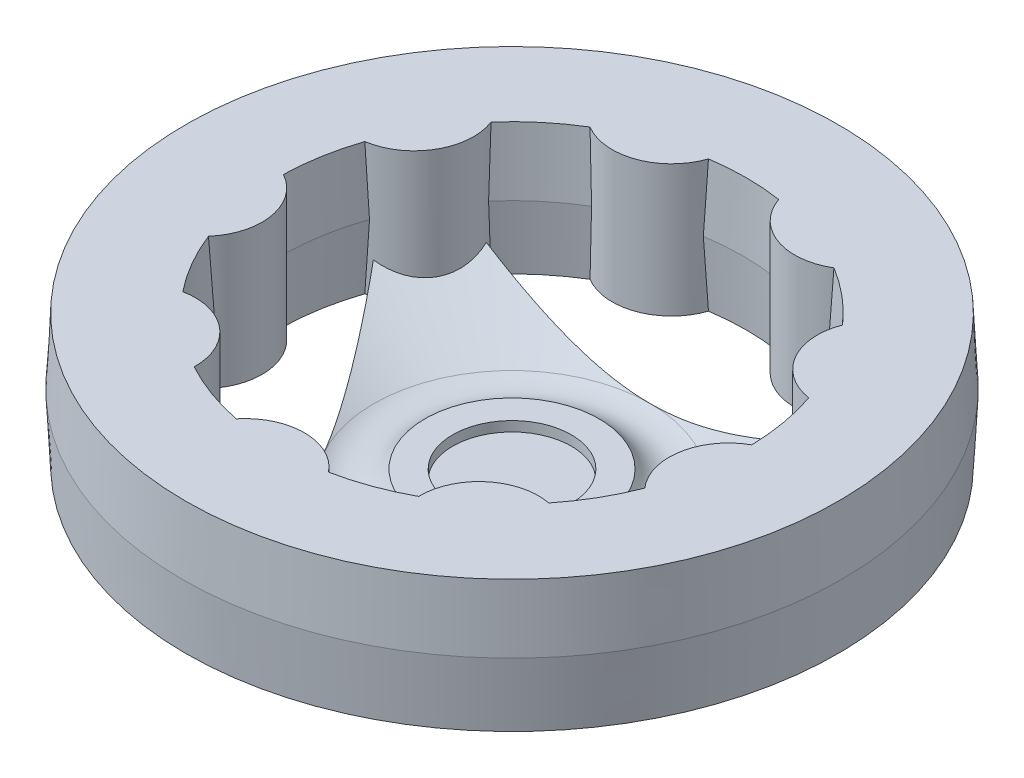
SolidWorks part; units mm, degrees
ref_plane "Front Plane" through (0, 0, 0) normal (0, 0, 1) x (1, 0, 0)
ref_plane "Top Plane" through (0, 0, 0) normal (0, 1, 0) x (1, 0, 0)
ref_plane "Right Plane" through (0, 0, 0) normal (1, 0, 0) x (0, 0, -1)
sketch "Sketch1" plane through (0, 0, 0) normal (0, 0, 1) x (1, 0, 0)
  line L0 (0, 0) -> (0, 45.9521) construction
  line L1 (0, 0) -> (12, 0)
  line L2 (12, 0) -> (12, -9.6)
  line L3 (12, -9.6) -> (13.2, -10.8)
  line L4 (13.2, -10.8) -> (13.2, -12)
  line L5 (13.2, -12) -> (12, -12)
  line L6 (12, -12) -> (12, -23.6)
  line L7 (11.6, -24) -> (2.4, -24)
  line L8 (0, -6) -> (0, 0)
  line L9 (0, -6) -> (2, -7.1547)
  line L10 (2, -7.1547) -> (2, -23.6)
  line L11 (2, -23.6) -> (2.4, -24)
  line L12 (12, -23.6) -> (11.6, -24)
  point P9 (12, -24)
  point P13 (2, -24)
revolve "Revolve1" add sketch "Sketch1" angle 360 about L0
sketch "Sketch2" plane through (0, 0, 0) normal (0, 0, 1) x (1, 0, 0)
  line L0 (12, 0) -> (-12, 0) construction
  line L1 (12, -9.6) -> (12, 0) construction
  line L2 (13.2, -10.8) -> (12, -9.6) construction
  line L3 (13.2, -12) -> (13.2, -10.8) construction
  line L4 (12, 0) -> (9, 0)
  line L5 (12, -9.6) -> (12, 0)
  line L6 (13.2, -10.8) -> (12, -9.6)
  line L7 (13.2, -12) -> (13.2, -10.8)
  line L8 (9, 0) -> (9, 1.5)
  line L9 (9, 1.5) -> (13.2, 1.5)
  line L10 (13.2, -12) -> (14.4, -12)
  line L11 (14.4, -12) -> (14.4, -9.0622)
  line L12 (15.9916, -6.4134) -> (32.8129, 2.5307)
  line L13 (38, 2) -> (38, 19)
  line L14 (38, 19) -> (47, 19)
  line L15 (47, 19) -> (47, 2)
  line L16 (47, 2) -> (49.4759, 2)
  line L17 (50, 2) -> (50, 22) construction
  line L18 (49.4759, 22) -> (35.5241, 22)
  line L19 (35, 22) -> (35, 2) construction
  line L20 (35, 2) -> (38, 2)
  line L21 (0, 0) -> (0, -29.5318) construction
  line L22 (-11.6, -24) -> (11.6, -24) construction
  line L23 (20.9484, -0.3801) -> (35, 7.0913)
  line L24 (50, 12) -> (49.4759, 22)
  line L25 (50, 12) -> (49.4759, 2)
  line L26 (50, 12) -> (35, 12) construction
  line L27 (35, 12) -> (35.5241, 22)
  line L28 (35, 12) -> (35, 7.0913)
  line L29 (13.2, 1.5) -> (13.2, -4.5) construction
  line L30 (13.2, -4.5) -> (20.9484, -0.3801) construction
  line L31 (32.8129, 2.5307) -> (35, 3.6936) construction
  arc A0 (35, 2) -> (32.8129, 2.5307) centre (33.608, 1.0354) ccw
  arc A1 (13.2, 1.5) -> (20.9484, -0.3801) centre (18.1316, 4.9176) ccw
  arc A2 (15.9916, -6.4134) -> (14.4, -9.0622) centre (17.4, -9.0622) ccw
  point P30 (14.4, -7.2597)
revolve "Revolve2" add sketch "Sketch2" angle 360 about L21
sketch "Sketch3" plane through (0, 22, 0) normal (0, 1, 0) x (1, 0, 0)
  line L0 (0, 0) -> (0, 72.8617) construction
  line L1 (0, 0) -> (68.2353, 39.3957) construction
  line L2 (0, 0) -> (-63.5801, 36.708) construction
  line L3 (0, 0) -> (26.8116, 22.4976) construction
  line L4 (0, 0) -> (-26.8116, 22.4976) construction
  arc A2 (26.8116, 22.4976) -> (-26.8116, 22.4976) centre (0, 0) ccw
  arc A3 (-26.8116, 22.4976) -> (26.8116, 22.4976) centre (0, 253.735) ccw
  circle A4 centre (0, 0) radius 20.9484 construction
  circle A5 centre (0, 0) radius 35 construction
  dimension "D1" = 120
  dimension "D2" = 10
extrude "Extrude1" cut sketch "Sketch3" against normal through all
pattern_circular "CirPattern1" count 3 over 360 about axis through (0, 0, 0) along (0, 1, 0) of "Extrude1"
ref_plane "Plane2" through (0, 12, 0) normal (0, 1, 0) x (-1, 0, 0)
draft "Draft5" type of draft neutral plane draft angle 3 neutral plane "Plane2" faces to draft 1 parameters "D1"=3
sketch "Sketch5" plane through (0, 22, 0) normal (0, 1, 0) x (1, 0, 0)
  line L0 (0, -35.5241) -> (0, -49.4759) construction
  circle A0 centre (0, 0) radius 35.5241 construction
  circle A1 centre (0, 0) radius 49.4759 construction
  arc A2 (7.0059, -34.8264) -> (-7.0059, -34.8264) centre (0, -40.4759) ccw
  arc A3 (-7.0059, -34.8264) -> (7.0059, -34.8264) centre (0, 0) ccw
  arc A4 (-7.0059, -34.8264) -> (7.0059, -34.8264) centre (0, -40.4759) ccw construction
  dimension "D1" = 9
extrude "Extrude2" add sketch "Sketch5" against normal up to surface (20 mm away)
pattern_circular "CirPattern2" count 9 over 360 about axis through (0, 0, 0) along (0, 1, 0) of "Extrude2"
sketch "Sketch6" plane through (0, 19, 0) normal (0, -1, 0) x (1, 0, 0)
  circle A1 centre (0, 40.4759) radius 9
  arc A2 (-7.0059, 34.8264) -> (-2.1679, 31.7409) centre (0, 40.4759) ccw construction
extrude "Extrude3" add sketch "Sketch6" along normal up to surface (17 mm away)
sketch "Sketch9" plane through (0, 0, 0) normal (1, 0, 0) x (0, 0, -1)
  line L0 (-40.4759, 5.64) -> (-40.4759, -17.9981) construction
  line L1 (-40.4759, 2) -> (-40.4759, 22) construction
  line L2 (-34.4759, 2) -> (-34.4759, 5)
  line L3 (-34.8264, 2) -> (-31.7409, 2) construction
  line L4 (-34.4759, 5) -> (-37.4759, 8)
  line L5 (-37.4759, 8) -> (-37.4759, 12)
  line L6 (-37.4759, 12) -> (-40.4759, 12)
  line L7 (-40.4759, 12) -> (-40.4759, 2)
  line L8 (-46.5252, 2) -> (-37.0751, 2) construction
  line L9 (-40.4759, 2) -> (-34.4759, 2)
  dimension "D1" = 45
  dimension "D2" = 12
  dimension "D3" = 3
  dimension "D4" = 3
  dimension "D5" = 4
revolve "Cut-Revolve1" cut sketch "Sketch9" angle 360 about L0
equation "\"D3@Sketch1\" = \"D2@Sketch1\"*.05"
equation "\"D8@Sketch1\" = \"D5@Sketch1\"*0.75"
equation "\"D9@Sketch1\" = \"D6@Sketch1\"*0.1"
equation "\"D12@Sketch1\" = \"D9@Sketch1\""
equation "\"D10@Sketch1\" = \"D9@Sketch1\""
equation "\"D11@Sketch1\" = \"D9@Sketch1\""
equation "\"D4@Sketch2\" = \"D3@Sketch2\"*0.15"
equation "\"D5@Sketch2\" = \"D4@Sketch2\""
equation "\"D8@Sketch2\" = \"D5@Sketch2\""
equation "\"D12@Sketch2\" = \"D6@Sketch2\"*0.06"
equation "\"D1@Sketch2\" = \"D3@Sketch1\""
equation "\"D15@Sketch2\" = \"D9@Sketch2\""
equation "\"D17@Sketch2\" = \"D9@Sketch2\"*0.5"
equation "\"D11@Sketch2\" = \"D22@Sketch2\""
